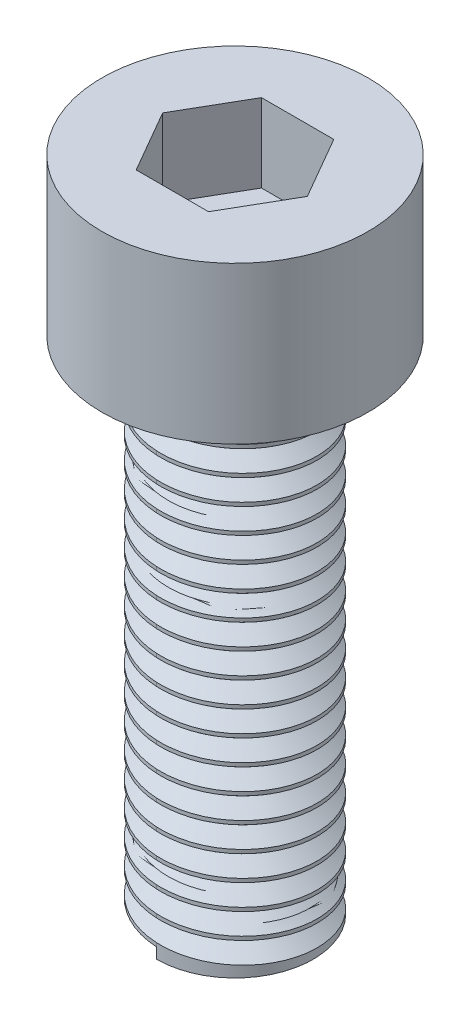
SolidWorks part; units mm, degrees
ref_plane "Alzado" through (0, 0, 0) normal (0, 0, 1) x (1, 0, 0)
ref_plane "Planta" through (0, 0, 0) normal (0, 1, 0) x (1, 0, 0)
ref_plane "Vista lateral" through (0, 0, 0) normal (1, 0, 0) x (0, 0, -1)
sketch "Sk_Cabeza" plane through (0, 0, 0) normal (0, 1, 0) x (1, 0, 0)
  circle A0 centre (0, 0) radius 4.25
  dimension "DIAM1" = 8.5
extrude "Cabeza" add sketch "Sk_Cabeza" along normal blind 5 from offset 0
sketch "Sk_Cana" plane through (0, 0, 0) normal (0, 1, 0) x (1, 0, 0)
  circle A0 centre (0, 0) radius 2.5
  dimension "DIAM2" = 5
extrude "Cana_rosca" add sketch "Sk_Cana" along normal blind 16 from offset 16
ref_plane "Plano_cabeza" through (0, 5, 0) normal (0, 1, 0) x (1, 0, 0)
sketch "Sk_Hueco_Allen" plane through (0, 5, 0) normal (0, 1, 0) x (1, 0, 0)
  line L0 (2.3094, 0) -> (1.1547, -2)
  line L1 (1.1547, -2) -> (-1.1547, -2)
  line L2 (-1.1547, -2) -> (-2.3094, 0)
  line L3 (-2.3094, 0) -> (-1.1547, 2)
  line L4 (-1.1547, 2) -> (1.1547, 2)
  line L5 (1.1547, 2) -> (2.3094, 0)
extrude "Hueco_Allen" cut sketch "Sk_Hueco_Allen" against normal blind 2.5
ref_plane "Plano_punta" through (0, -16, 0) normal (0, 1, 0) x (1, 0, 0)
sketch "Sk_Helice" plane through (0, -16, 0) normal (0, 1, 0) x (1, 0, 0)
  circle A0 centre (0, 0) radius 2.5
curve "Helice_rosca"
sketch "Sk_Perfil_rosca" plane through (0, 0, 0) normal (1, 0, 0) x (0, 0, -1)
  line L0 (-2.7, -16.48) -> (-2.0093, -16)
  line L1 (-2.0093, -16) -> (-2.7, -15.52)
  line L2 (-2.7, -15.52) -> (-2.7, -16.48)
sweep "Rosca_M5x0_8" cut profiles "Sk_Perfil_rosca" path "Helice_rosca"
